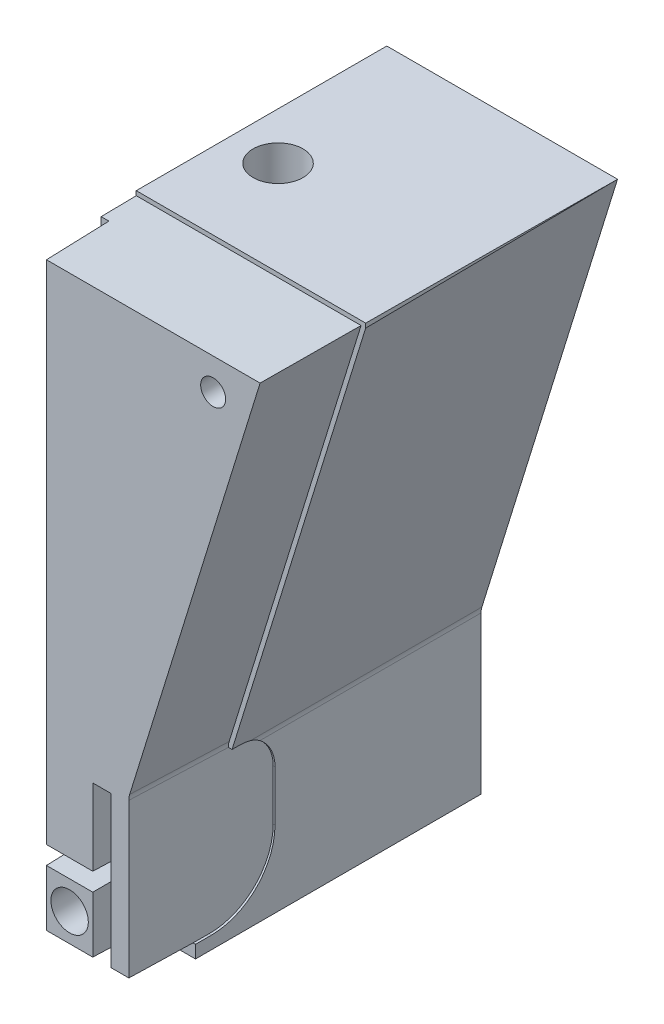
SolidWorks part; units mm, degrees
ref_plane "Plan de face" through (0, 0, 0) normal (0, 0, 1) x (1, 0, 0)
ref_plane "Plan de dessus" through (0, 0, 0) normal (0, 1, 0) x (1, 0, 0)
ref_plane "Plan de droite" through (0, 0, 0) normal (1, 0, 0) x (0, 0, -1)
imported_body "Importée1"
sketch "Esquisse1" plane through (0, 0, 0) normal (0, 0, 1) x (1, 0, 0)
  circle A0 centre (34, 33.9925) radius 2
  circle A1 centre (34, 33.9925) radius 3 construction
  circle A2 centre (34, 33.9925) radius 3
  dimension "D1" = 4
extrude "Extrusion1" add sketch "Esquisse1" against normal up to surface (56 mm away)
